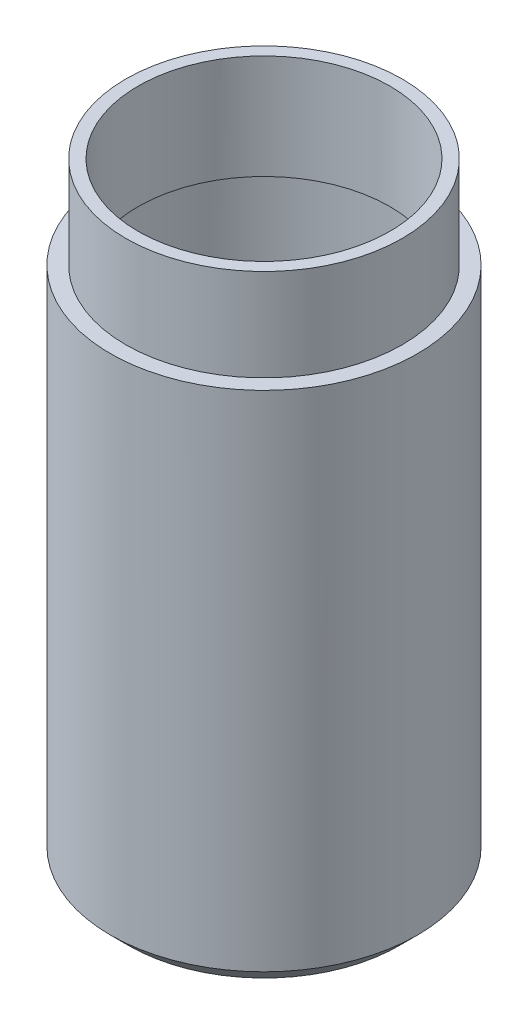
SolidWorks part; units mm, degrees
other "<臭屁探测器一级控件>-<<臭屁探测器>-<倒角2>>"
ref_plane "前视基准面" through (0, 0, 0) normal (0, 0, 1) x (1, 0, 0)
ref_plane "上视基准面" through (0, 0, 0) normal (0, 1, 0) x (1, 0, 0)
ref_plane "右视基准面" through (0, 0, 0) normal (1, 0, 0) x (0, 0, -1)
inserted part "臭屁探测器一级控件"
ref_plane "基准面2" through (0, 85, 0) normal (0, -1, 0) x (-1, 0, 0)
sketch "草图2" plane through (0, 85, 0) normal (0, -1, 0) x (-1, 0, 0)
  circle A0 centre (0, 0) radius 120.2315
extrude "切除-拉伸1" cut sketch "草图2" against normal blind 248
sketch "草图3" plane through (0, 85, 0) normal (0, 1, 0) x (1, 0, 0)
  circle A0 centre (0, 0) radius 22.5
  dimension "D1" = 45
extrude "凸台-拉伸1" add sketch "草图3" along normal blind 15
shell "抽壳1" thickness 2
